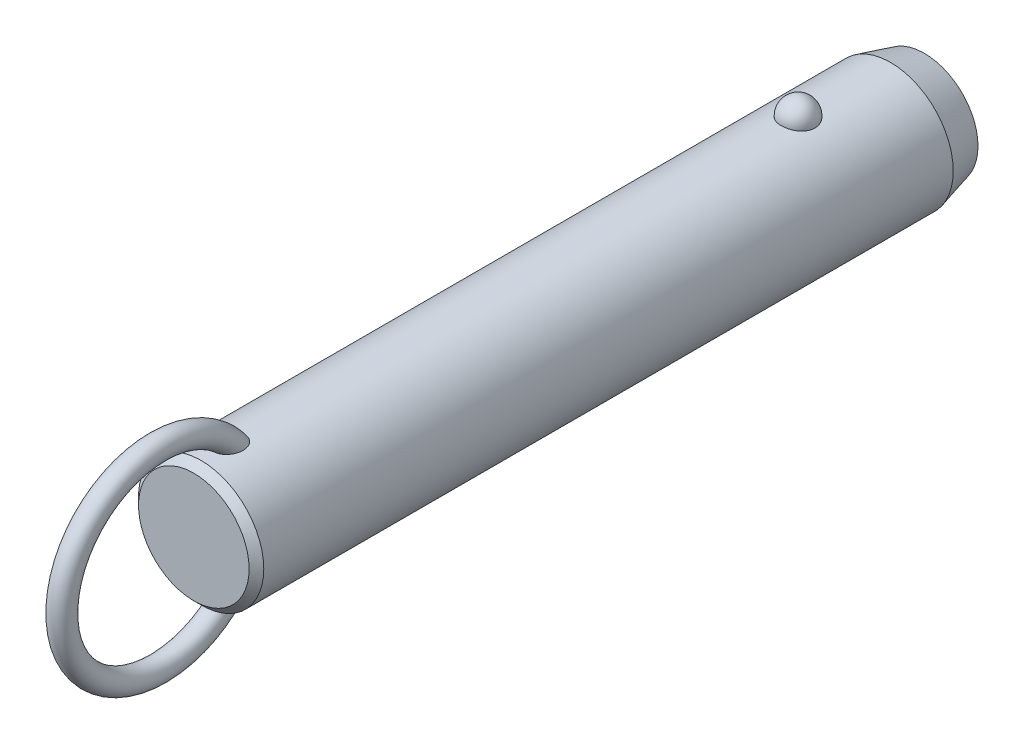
SolidWorks part; units mm, degrees
ref_plane "Front Plane" through (0, 0, 0) normal (0, 0, 1) x (1, 0, 0)
ref_plane "Top Plane" through (0, 0, 0) normal (0, 1, 0) x (1, 0, 0)
ref_plane "Right Plane" through (0, 0, 0) normal (1, 0, 0) x (0, 0, -1)
sketch "Sketch2" plane through (0, 0, 0) normal (0, 0, 1) x (1, 0, 0)
  circle A0 centre (0, 0) radius 11.1
  point P3 (0, 11.1)
  dimension "D1" = 22.2
extrude "Boss-Extrude1" add sketch "Sketch2" along normal blind 91.4
sketch "Sketch3" plane through (0, 0, 0) normal (0, 0, -1) x (-1, 0, 0)
  circle A0 centre (0, 0) radius 11.1
  dimension "D1" = 22.2
extrude "Boss-Extrude2" add sketch "Sketch3" along normal blind 25.4
chamfer "Chamfer1" distance 6 angle 15 1 edges at (-11.1, 0, -25.4)
sketch "Sketch12" plane through (0, 0, 0) normal (1, 0, 0) x (0, 0, -1)
  line L0 (-91.4, 11.1) -> (-91.4, -11.1) construction
  point P0 (-91.4, 0)
sketch "Sketch13" plane through (0, 0, 0) normal (1, 0, 0) x (0, 0, -1)
  circle A0 centre (-110.45, 0) radius 19.05
  point P2 (-91.4, 0)
  dimension "D1" = 38.1
sketch "Sketch14" plane through (0, 0, 0) normal (0, 1, 0) x (1, 0, 0)
  circle A0 centre (0, -93.4) radius 2
  point P2 (0, -91.4)
  dimension "D1" = 4
sweep "Sweep1" add profiles "Sketch14" path "Sketch13"
sketch "Sketch15" plane through (0, 0, 91.4) normal (0, 0, 1) x (1, 0, 0)
  circle A0 centre (0, 0) radius 11.1
  dimension "D1" = 22.2
extrude "Boss-Extrude3" add sketch "Sketch15" along normal blind 12.7
chamfer "Chamfer2" distance 1.3 angle 45 1 edges at (11.1, 0, 104.1)
sketch "Sketch18" plane through (0, 0, 0) normal (1, 0, 0) x (0, 0, -1)
  line L0 (19.4, 11.1) -> (-94.968, 11.1) construction
  line L1 (3, 14.1) -> (3, 8.1)
  line L2 (-94.968, -11.1) -> (19.4, -11.1) construction
  arc A0 (3, 14.1) -> (3, 8.1) centre (3, 11.1) ccw
  point P4 (0, 11.1)
  dimension "D1" = 25.2
revolve "Revolve1" add sketch "Sketch18" angle 360 about L1
